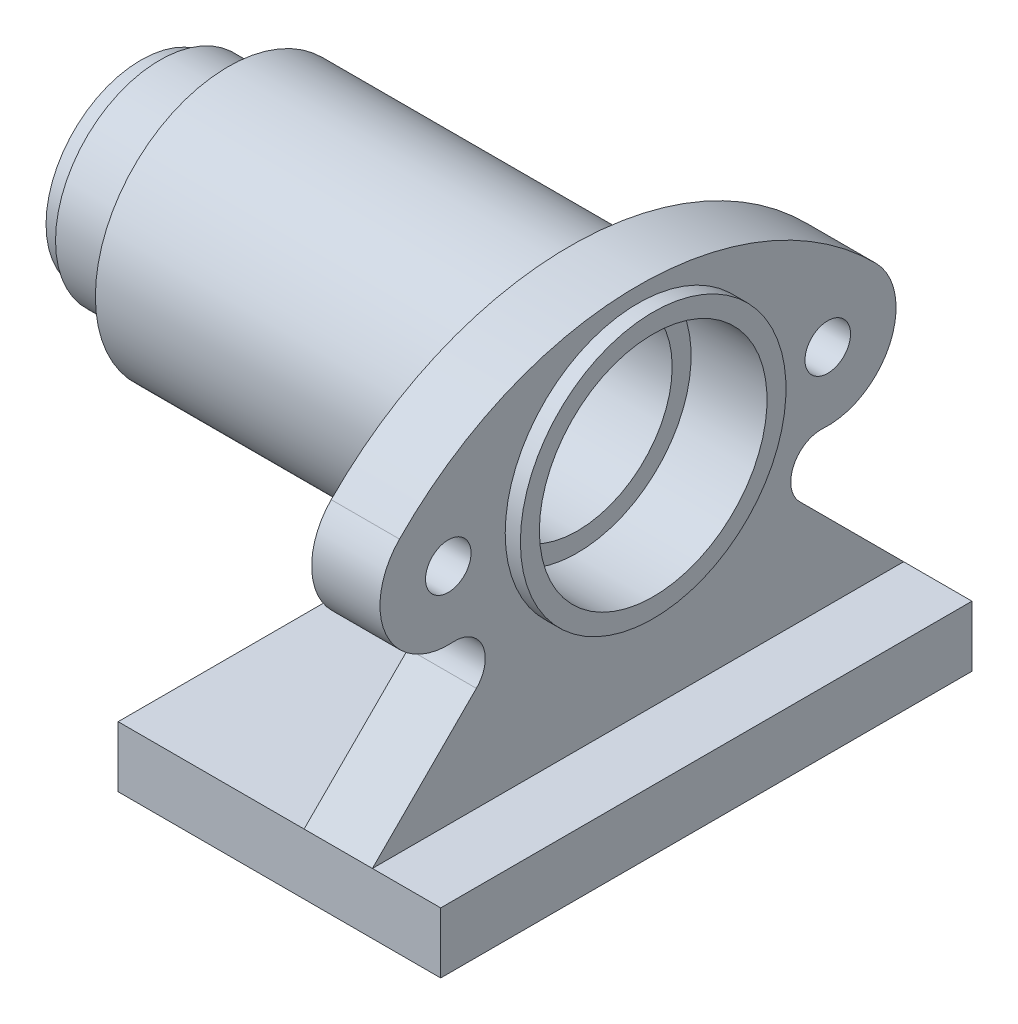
SolidWorks part; units mm, degrees
ref_plane "前视基准面" through (0, 0, 0) normal (0, 0, 1) x (1, 0, 0)
ref_plane "上视基准面" through (0, 0, 0) normal (0, 1, 0) x (1, 0, 0)
ref_plane "右视基准面" through (0, 0, 0) normal (1, 0, 0) x (0, 0, -1)
sketch "草图1" plane through (0, 0, 0) normal (0, 0, 1) x (1, 0, 0)
  line L0 (0, 0) -> (0, 16)
  line L1 (0, 16) -> (-85, 16)
  line L2 (-85, 16) -> (-85, 0)
  line L3 (-85, 0) -> (0, 0)
  dimension "D1" = 85
  dimension "D2" = 16
extrude "凸台-拉伸2" add sketch "草图1" along normal mid plane 140
ref_plane "基准面1" through (-14, 0, 0) normal (1, 0, 0) x (0, 0, -1)
sketch "草图2" plane through (0, 0, 0) normal (0, 0, 1) x (1, 0, 0)
  line L0 (-107.0679, 75) -> (-6.4484, 75) construction
  line L1 (-149, 91) -> (-149, 100)
  line L2 (-149, 100) -> (-144, 100)
  line L3 (-144, 100) -> (-144, 102.5)
  line L4 (-144, 102.5) -> (-126, 102.5)
  line L5 (-126, 102.5) -> (-126, 110)
  line L6 (-126, 110) -> (-14, 110)
  line L7 (-14, -8.8) -> (-14, 8.8) construction
  line L8 (-14, 110) -> (-14, 105)
  line L9 (-34, 100) -> (-114, 100)
  line L10 (-114, 100) -> (-114, 91)
  line L11 (-114, 91) -> (-149, 91)
  line L13 (-34, 100) -> (-34, 105)
  line L14 (-34, 105) -> (-14, 105)
  dimension "D1" = 35
  dimension "D2" = 30
  dimension "D3" = 25
  dimension "D4" = 18
  dimension "D5" = 112
  dimension "D6" = 135
  dimension "D7" = 20
  dimension "D8" = 80
  dimension "D9" = 16
  dimension "D10" = 75
  dimension "D11" = 25
  dimension "D12" = 27.5
revolve "旋转2" add sketch "草图2" angle 360 about L0
ref_plane "基准面2" through (-18, 0, 0) normal (1, 0, 0) x (0, 0, -1)
sketch "草图3" plane through (-18, 0, 0) normal (1, 0, 0) x (0, 0, -1)
  line L0 (0, -12.8905) -> (0, 132.0575) construction
  line L1 (77.2721, 75) -> (-87.1296, 75) construction
  line L2 (-50, 105.8207) -> (-50, 42.5784) construction
  line L3 (-70, 16) -> (-42.5982, 43.4018)
  line L4 (-70, 16) -> (70, 16) construction
  line L5 (-70, 16) -> (70, 16)
  line L6 (70, 16) -> (42.5982, 43.4018)
  circle A0 centre (-50, 75) radius 6
  arc A1 (-48.792, 57.0406) -> (-62.8571, 87.5974) centre (-50, 75) cw
  arc A2 (-42.5982, 43.4018) -> (-48.792, 57.0406) centre (-48.2551, 49.0586) ccw
  arc A3 (42.5982, 43.4018) -> (48.792, 57.0406) centre (48.2551, 49.0586) cw
  circle A4 centre (50, 75) radius 6
  arc A5 (48.792, 57.0406) -> (62.8571, 87.5974) centre (50, 75) ccw
  arc A6 (-62.8571, 87.5974) -> (62.8571, 87.5974) centre (0, 26.0102) cw
  circle A7 centre (0, 75) radius 35
  dimension "D2" = 12
  dimension "D3" = 18
  dimension "D4" = 8
  dimension "D6" = 88
  dimension "D7" = 70
  dimension "D1" = 50
  dimension "D5" = 45
extrude "凸台-拉伸3" add sketch "草图3" against normal blind 18
sketch "草图4" plane through (0, 0, 0) normal (0, 0, 1) x (1, 0, 0)
  line L0 (0, 16) -> (-14, 40)
  line L1 (-14, 40) -> (-14, 110) construction
sketch "草图5" plane through (0, 0, 0) normal (0, 0, 1) x (1, 0, 0)
  line L0 (-85, 16) -> (-117, 40)
  line L1 (-126, 40) -> (-36, 40) construction
  dimension "D1" = 32
